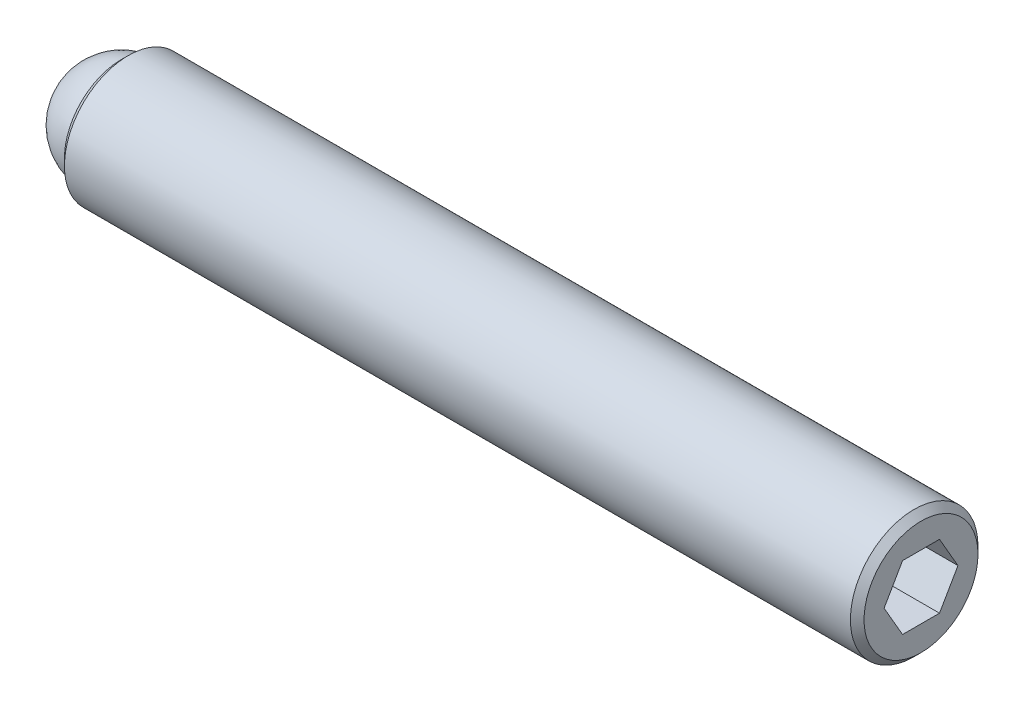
SolidWorks part; units mm, degrees
ref_plane "Front Plane" through (0, 0, 0) normal (0, 0, 1) x (1, 0, 0)
ref_plane "Top Plane" through (0, 0, 0) normal (0, 1, 0) x (1, 0, 0)
ref_plane "Right Plane" through (0, 0, 0) normal (1, 0, 0) x (0, 0, -1)
sketch "Sketch2" plane through (0, 0, 0) normal (1, 0, 0) x (0, 0, -1)
  circle A0 centre (0, 0) radius 2.3749
  dimension "D1" = 4.7498
extrude "Boss-Extrude1" add sketch "Sketch2" along normal blind 29.7656
sketch "Sketch3" plane through (0, 0, 0) normal (-1, 0, 0) x (0, 0, 1)
  circle A0 centre (0, 0) radius 1.9812
  dimension "D1" = 3.9624
chamfer "Chamfer1" distance 0.254 angle 45 1 edges at (0, 0, -2.3749)
chamfer "Chamfer2" distance 0.254 angle 45 1 edges at (29.7656, 0, -2.3749)
sketch "Sketch4" plane through (29.7656, 0, 0) normal (1, 0, 0) x (0, 0, -1)
  line L1 (1.3748, 0) -> (0.6874, 1.1906)
  line L2 (0.6874, 1.1906) -> (-0.6874, 1.1906)
  line L3 (-0.6874, 1.1906) -> (-1.3748, 0)
  line L4 (-1.3748, 0) -> (-0.6874, -1.1906)
  line L5 (-0.6874, -1.1906) -> (0.6874, -1.1906)
  line L6 (0.6874, -1.1906) -> (1.3748, 0)
  circle A0 centre (0, 0) radius 1.1906 construction
  dimension "D1" = 2.3813
extrude "Cut-Extrude2" cut sketch "Sketch4" against normal blind 2.286
extrude "Cut-Extrude3" cut sketch "Sketch3" against normal blind 1.9844
sketch "Sketch5" plane through (0, 0, 0) normal (-1, 0, 0) x (0, 0, 1)
  line L0 (0, 0) -> (0, -1.9844)
  line L1 (0, 0) -> (0, 1.9844)
  arc A0 (0, 1.9844) -> (0, -1.9844) centre (0, 0) ccw
  dimension "D1" = 1.9844
revolve "Revolve1" add sketch "Sketch5" angle 360 about L1
